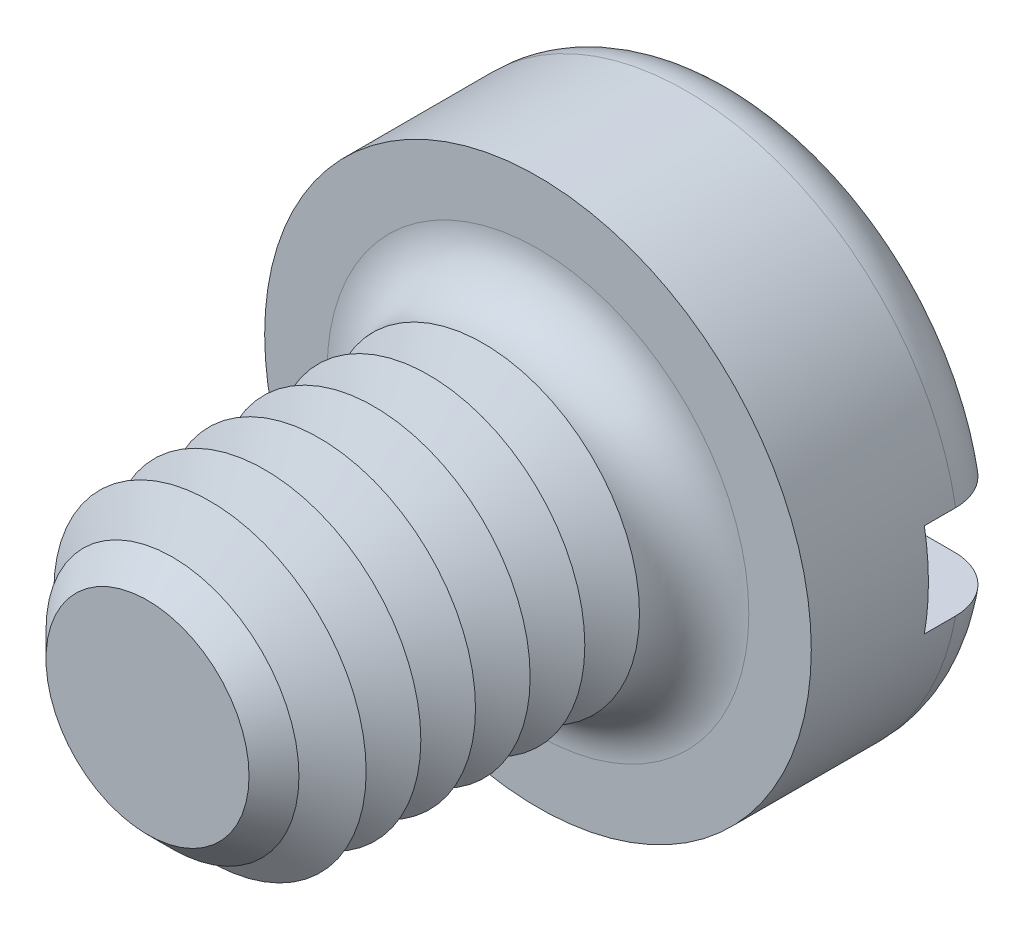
SolidWorks part; units mm, degrees
ref_plane "Front Plane" through (0, 0, 0) normal (0, 0, 1) x (1, 0, 0)
ref_plane "Top Plane" through (0, 0, 0) normal (0, 1, 0) x (1, 0, 0)
ref_plane "Right Plane" through (0, 0, 0) normal (1, 0, 0) x (0, 0, -1)
sketch "Sketch3" plane through (0, 0, 0) normal (0, 0, 1) x (1, 0, 0)
  circle A0 centre (0, 0) radius 3.5
  dimension "D1" = 7
extrude "Boss-Extrude2" add sketch "Sketch3" against normal blind 2.6
sketch "Sketch4" plane through (0, 0, 0) normal (0, 0, 1) x (1, 0, 0)
  circle A0 centre (0, 0) radius 2
  dimension "D1" = 4
extrude "Boss-Extrude3" add sketch "Sketch4" along normal blind 5
fillet "Fillet1" radius 0.7 2 edges at (3.5, 0, -2.6) (2, 0, 0)
chamfer "Chamfer1" distance 0.7 angle 45 1 edges at (2, 0, 5)
sketch "Sketch5" plane through (0, 0, 0) normal (1, 0, 0) x (0, 0, -1)
  line L0 (1.6944, 0) -> (-7.6738, 0) construction
sketch "Sketch6" plane through (0, 0, 0) normal (1, 0, 0) x (0, 0, -1)
  line L0 (-0.7, 2) -> (-1.05, 1.3938)
  line L1 (-1.05, 1.3938) -> (-1.4, 2)
  line L2 (-0.7, 2) -> (-4.3, 2) construction
  line L3 (-1.4, 2) -> (-0.7, 2)
  dimension "D1" = 0.7
revolve "Cut-Revolve1" cut sketch "Sketch6" angle 360 about L0
pattern_linear "LPattern1" count 6 spacing 0.7 along (0, 0, 1) of "Cut-Revolve1"
sketch "Sketch8" plane through (0, 0, -2.6) normal (0, 0, -1) x (-1, 0, 0)
  line L1 (3.5, -0.6) -> (-3.5, -0.6)
  line L2 (3.5, -0.6) -> (3.5, 0.6)
  line L3 (3.5, 0.6) -> (-3.5, 0.6)
  line L4 (-3.5, -0.6) -> (-3.5, 0.6)
  line L5 (3.5, -0.6) -> (-3.5, 0.6) construction
  line L6 (3.5, 0.6) -> (-3.5, -0.6) construction
  point P0 (0, 0)
  dimension "D1" = 7
  dimension "D2" = 1.2
extrude "Cut-Extrude1" cut sketch "Sketch8" against normal blind 1.1
